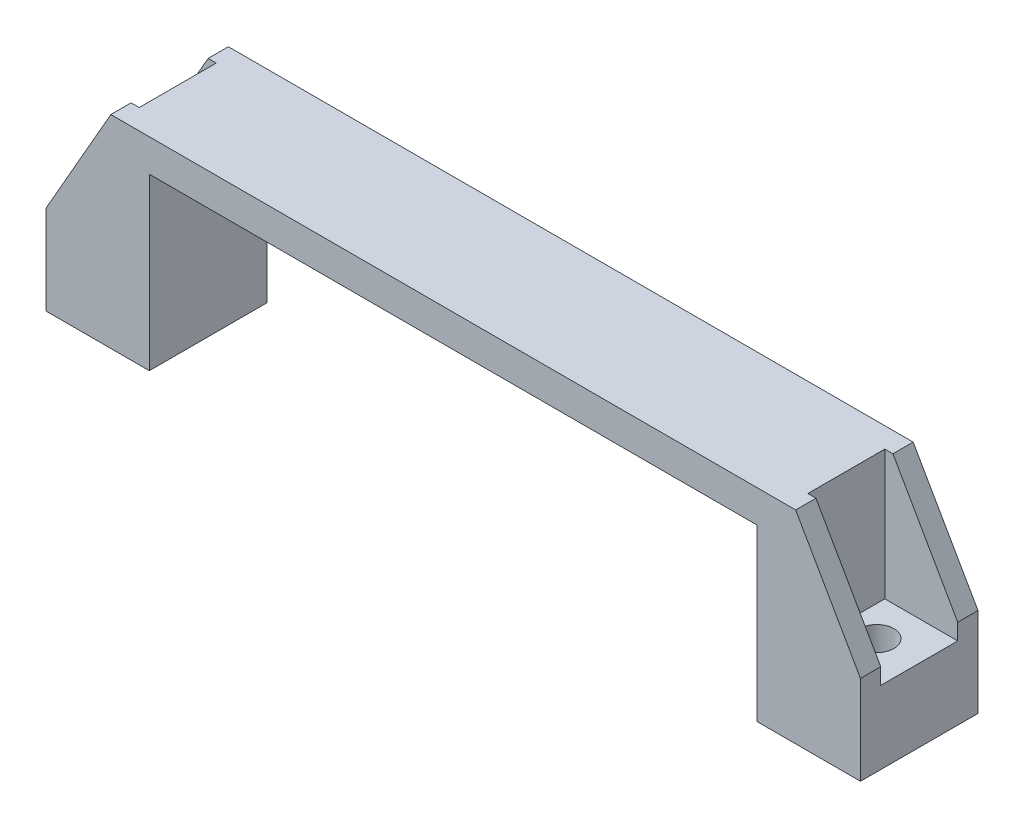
SolidWorks part; units mm, degrees
ref_plane "前视基准面" through (0, 0, 0) normal (0, 0, 1) x (1, 0, 0)
ref_plane "上视基准面" through (0, 0, 0) normal (0, 1, 0) x (1, 0, 0)
ref_plane "右视基准面" through (0, 0, 0) normal (1, 0, 0) x (0, 0, -1)
sketch "草图2" plane through (0, 0, 0) normal (0, 0, 1) x (1, 0, 0)
  line L1 (-100.5, 25) -> (100.5, 25)
  line L2 (-100.5, 25) -> (-100.5, -25)
  line L3 (-100.5, -25) -> (100.5, -25)
  line L4 (100.5, 25) -> (100.5, -25)
  dimension "D1" = 201
  dimension "D2" = 50
  dimension "D3" = 100.5
  dimension "D4" = 25
extrude "凸台-拉伸1" add sketch "草图2" along normal mid plane 29
sketch "草图3" plane through (0, 0, 14.5) normal (0, 0, 1) x (1, 0, 0)
  line L0 (-100.5, -25) -> (100.5, -25) construction
  line L1 (-75, 17) -> (75, 17)
  line L2 (-75, 17) -> (-75, -25)
  line L3 (-75, -25) -> (75, -25)
  line L4 (75, 17) -> (75, -25)
  line L5 (-100.5, 25) -> (-100.5, -25) construction
  line L6 (-84.5, 25) -> (-100.5, 25)
  line L7 (100.5, 25) -> (-100.5, 25) construction
  line L8 (-100.5, 25) -> (-100.5, -3)
  line L9 (-100.5, -3) -> (-84.5, 25)
  line L10 (0, 25) -> (0, -25) construction
  line L11 (100.5, -3) -> (84.5, 25)
  line L12 (100.5, 25) -> (100.5, -3)
  line L13 (84.5, 25) -> (100.5, 25)
  dimension "D1" = 150
  dimension "D2" = 42
  dimension "D3" = 25.5
  dimension "D4" = 16
  dimension "D5" = 28
extrude "切除-拉伸1" cut sketch "草图3" against normal through all
sketch "草图4" plane through (0, -25, 0) normal (0, -1, 0) x (1, 0, 0)
  circle A0 centre (-90, 0) radius 4.25
  circle A1 centre (90, 0) radius 4.25
  dimension "D1" = 180
  dimension "D2" = 90
  dimension "D3" = 8.5
  dimension "D4" = 8.5
extrude "切除-拉伸2" cut sketch "草图4" against normal through all
sketch "草图5" plane through (0, 25, 0) normal (0, 1, 0) x (1, 0, 0)
  line L1 (-100.5, 14.5) -> (-100.5, -14.5) construction
  line L2 (-100.5, 9.5) -> (-82.5, 9.5)
  line L3 (-100.5, 9.5) -> (-100.5, -9.5)
  line L4 (-100.5, -9.5) -> (-82.5, -9.5)
  line L6 (-82.5, 9.5) -> (-82.5, -9.5)
  line L7 (-100.5, 14.5) -> (-84.5, 14.5) construction
  line L8 (0, 14.5) -> (0, -14.5) construction
  line L9 (84.5, 14.5) -> (-84.5, 14.5) construction
  line L10 (84.5, -14.5) -> (-84.5, -14.5) construction
  line L11 (82.5, 9.5) -> (82.5, -9.5)
  line L12 (100.5, -9.5) -> (82.5, -9.5)
  line L13 (100.5, 9.5) -> (100.5, -9.5)
  line L14 (100.5, 9.5) -> (82.5, 9.5)
  dimension "D1" = 18
  dimension "D2" = 19
  dimension "D3" = 5
extrude "切除-拉伸3" cut sketch "草图5" against normal blind 32
